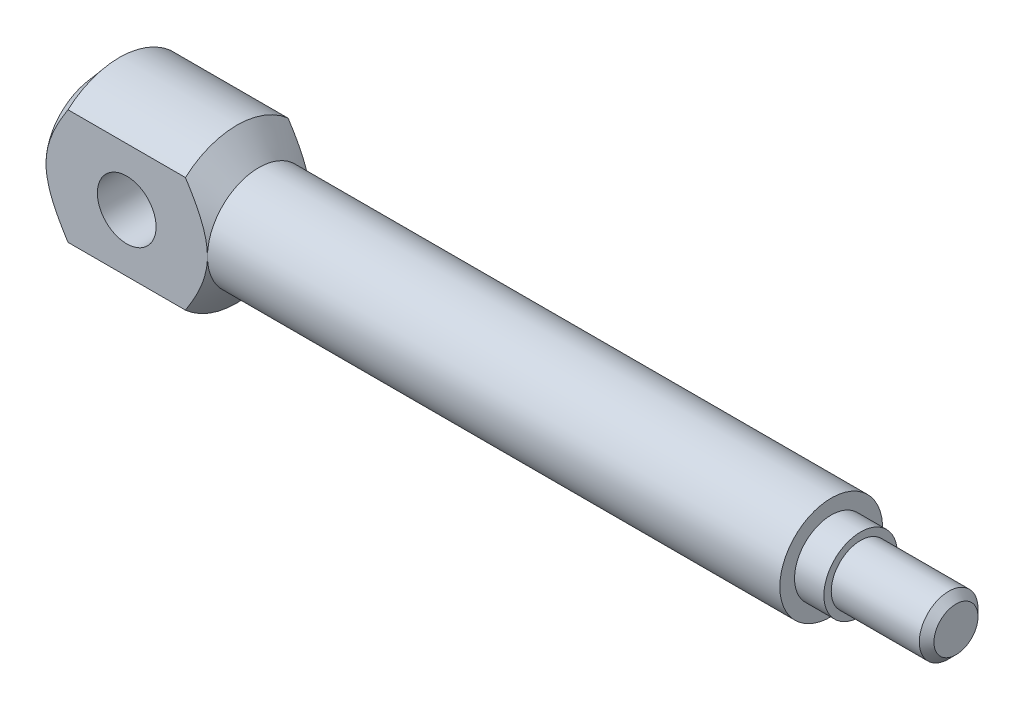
SolidWorks part; units mm, degrees
ref_plane "Plane1" through (0, 0, 0) normal (0, 0, 1) x (1, 0, 0)
ref_plane "Plane2" through (0, 0, 0) normal (0, 1, 0) x (1, 0, 0)
ref_plane "Plane3" through (0, 0, 0) normal (1, 0, 0) x (0, 0, -1)
sketch "Esquisse1" plane through (0, 0, 0) normal (0, 0, 1) x (1, 0, 0)
  line L0 (0, 0) -> (117, 0)
  line L1 (117, 0) -> (117, 4)
  line L2 (117, 4) -> (104, 4)
  line L3 (104, 4) -> (104, 5)
  line L4 (104, 5) -> (100, 5)
  line L5 (100, 5) -> (100, 7)
  line L6 (100, 7) -> (22, 7)
  line L7 (22, 7) -> (19, 10.5)
  line L8 (19, 10.5) -> (3, 10.5)
  line L9 (3, 10.5) -> (0, 7)
  line L10 (0, 7) -> (0, 0)
  line L11 (-40, 0) -> (140, 0) construction
  dimension "D1" = 3
  dimension "D2" = 19
  dimension "D3" = 22
  dimension "D4" = 78
  dimension "D5" = 4
  dimension "D6" = 13
  dimension "D7" = 4
  dimension "D8" = 5
  dimension "D9" = 7
  dimension "D10" = 10.5
  dimension "D11" = 7
revolve "Base-Révolution" add sketch "Esquisse1" angle 360 about L11
ref_plane "Plan5" through (0, 0, 7) normal (0, 0, 1) x (1, 0, 0)
sketch "Esquisse3" plane through (0, 0, 7) normal (0, 0, 1) x (1, 0, 0)
  line L0 (-10, 20) -> (40, 20)
  line L1 (-10, 20) -> (-10, -20)
  line L2 (40, -20) -> (-10, -20)
  line L3 (40, -20) -> (40, 20)
extrude "Enlèv. mat.-Extru.2" cut sketch "Esquisse3" along normal blind 10
ref_plane "Plan6" through (0, 0, -7) normal (0, 0, 1) x (1, 0, 0)
sketch "Esquisse4" plane through (0, 0, -7) normal (0, 0, 1) x (1, 0, 0)
  line L0 (-10, 20) -> (40, 20)
  line L1 (-10, 20) -> (-10, -20)
  line L2 (40, -20) -> (-10, -20)
  line L3 (40, -20) -> (40, 20)
extrude "Enlèv. mat.-Extru.4" cut sketch "Esquisse4" against normal blind 10
sketch "Esquisse6" plane through (0, 0, 7) normal (0, 0, 1) x (1, 0, 0)
  line L0 (0, -7) -> (0, 0) construction
  circle A0 centre (11, 0) radius 4
  dimension "D1" = 8
  dimension "D2" = 11
extrude "Enlèv. mat.-Extru.5" cut sketch "Esquisse6" against normal through all
chamfer "Chanfrein1" distance 1 angle 45
